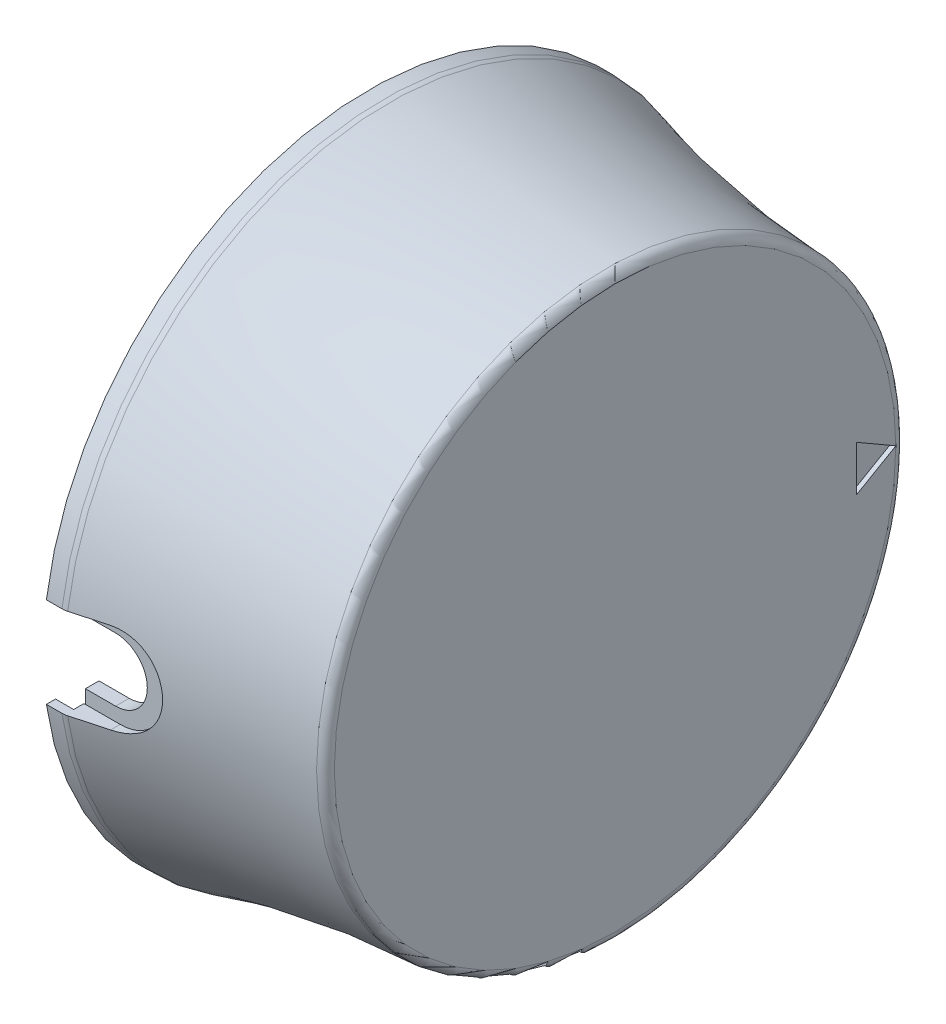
SolidWorks part; units mm, degrees
ref_plane "Plan de face" through (0, 0, 0) normal (0, 0, 1) x (1, 0, 0)
ref_plane "Plan de dessus" through (0, 0, 0) normal (0, 1, 0) x (1, 0, 0)
ref_plane "Plan de droite" through (0, 0, 0) normal (1, 0, 0) x (0, 0, -1)
sketch "Esquisse1" plane through (0, 0, 0) normal (0, 0, 1) x (1, 0, 0)
  line L0 (0, 0) -> (32.7513, 0) construction
  line L1 (0, 0) -> (0, 36)
  line L2 (0, 36) -> (1.7142, 36)
  line L3 (27.2, 0) -> (27.2, 31.0337)
  line L4 (27.2, 32) -> (14.7127, 32.3684) construction
  line L5 (0, 0) -> (27.2, 0)
  arc A0 (2.2717, 35.9207) -> (26.2391, 32.033) centre (30.1487, 131.9565) ccw
  arc A1 (27.2, 31.0337) -> (26.2391, 32.033) centre (26.2, 31.0337) ccw
  arc A2 (1.7142, 36) -> (2.2717, 35.9207) centre (1.7142, 34) cw
  point P14 (2, 36)
  dimension "D4" = 27.2
  dimension "D5" = 100
  dimension "D6" = 1
  dimension "D7" = 2
  dimension "D1" = 64
  dimension "D2" = 72
  dimension "D3" = 2
revolve "Révolution1" add sketch "Esquisse1" angle 360 about L5
shell "Coque1" thickness 2
sketch "Esquisse4" plane through (0, 0, 0) normal (-1, 0, 0) x (0, 0, 1)
  circle A2 centre (0, 0) radius 35
  circle A3 centre (0, 0) radius 35
  dimension "D1" = 1
extrude "Enlèv. mat.-Extru.2" cut sketch "Esquisse4" against normal blind 2
ref_plane "Plan1" through (0, 0, 32) normal (0, 0, 1) x (1, 0, 0)
sketch "Esquisse5" plane through (0, 0, 32) normal (0, 0, 1) x (1, 0, 0)
  line L0 (0, 36) -> (0, -36) construction
  line L1 (0, 5) -> (0, -5)
  line L2 (0, 0) -> (14.6376, 0) construction
  line L3 (0, 5) -> (25.2, 5)
  line L4 (0, -5) -> (25.2, -5)
  line L5 (25.2, 30.0766) -> (25.2, -30.0766) construction
  line L6 (25.2, 5) -> (25.2, -5)
  dimension "D1" = 10
extrude "Extrusion2" add sketch "Esquisse5" along normal up to surface (0.6915 mm away)
sketch "Esquisse6" plane through (0, 0, 32) normal (0, 0, -1) x (-1, 0, 0)
  line L0 (0, 3.5) -> (-5.5, 3.5)
  line L1 (0, -36) -> (0, 36) construction
  line L2 (-5.5, -3.5) -> (0, -3.5)
  line L3 (0, 0) -> (-12.0589, 0) construction
  line L4 (0, 5) -> (0, -5) construction
  line L5 (0, 3.5) -> (0, -3.5)
  arc A0 (-5.5, 3.5) -> (-5.5, -3.5) centre (-5.5, 0) ccw
  dimension "D2" = 9
  dimension "D1" = 7
extrude "Enlèv. mat.-Extru.3" cut sketch "Esquisse6" against normal through all
ref_plane "Plan2" through (0, 0, 37) normal (0, 0, -1) x (-1, 0, 0)
sketch "Esquisse7" plane through (0, 0, 37) normal (0, 0, -1) x (-1, 0, 0)
  line L0 (0, 0) -> (-12.3449, 0) construction
  line L1 (0, 5) -> (-6, 5)
  line L2 (-8.009, 5) -> (0, 5) construction
  line L3 (0, -5) -> (-8.009, -5) construction
  line L4 (-6, -5) -> (0, -5)
  line L5 (0, -36) -> (0, 36) construction
  line L6 (0, 5) -> (0, -5)
  arc A0 (-6, 5) -> (-6, -5) centre (-6, 0) ccw
  dimension "D1" = 11
extrude "Enlèv. mat.-Extru.4" cut sketch "Esquisse7" along normal offset from surface (3.5 mm away) 1.5
sketch "Esquisse8" plane through (0, 0, 33.5) normal (0, 0, 1) x (1, 0, 0)
  line L1 (2.1621, 5) -> (2.1621, -5)
  line L2 (2.1621, 5) -> (0, 5) construction
  line L3 (2.1621, 5) -> (0, 5)
  line L4 (0, -5) -> (2.1621, -5) construction
  line L5 (0, -5) -> (2.1621, -5)
  line L6 (0, 5) -> (0, -5)
extrude "Enlèv. mat.-Extru.5" cut sketch "Esquisse8" against normal up to next
sketch "Esquisse9" plane through (27.2, 0, 0) normal (1, 0, 0) x (0, 0, -1)
  line L0 (26.7036, 2.5) -> (26.7036, -2.5)
  line L1 (26.7036, -2.5) -> (31.0337, 0)
  line L2 (31.0337, 0) -> (26.7036, 2.5)
  circle A0 centre (0, 0) radius 31.0337 construction
  dimension "D1" = 5
extrude "Enlèv. mat.-Extru.6" cut sketch "Esquisse9" against normal blind 0.5
sketch "Esquisse10" plane through (0, 0, 0) normal (0, 1, 0) x (1, 0, 0)
  line L0 (0, 36) -> (0, -35.6511) construction
  line L1 (0, 32.2409) -> (0, 26)
  line L2 (0, 26) -> (22.332, 26)
  dimension "D1" = 26
rib "Nervure2" sketch "Esquisse10" sketch "Esquisse10" thickness 1.2 extrusion direction parallel to sketch draft on no parameters "D1"=1.2
sketch "Esquisse11" plane through (0, 0, 0) normal (0, 1, 0) x (1, 0, 0)
  line L0 (0, 26) -> (25.2, 26) construction
  line L1 (0, 26) -> (2.2, 26)
  line L2 (0, 34.9949) -> (0, 26) construction
  line L3 (0, 32) -> (0, 26)
  line L4 (0, 32) -> (2.2, 32)
  line L5 (2.2, 32) -> (2.2, 26)
  dimension "D1" = 2.2
  dimension "D2" = 6
extrude "Enlèv. mat.-Extru.7" cut sketch "Esquisse11" against normal up to next and the other way up to next
sketch "Esquisse12" plane through (25.2, 0, 0) normal (-1, 0, 0) x (0, 0, 1)
  line L0 (-26, -0.6) -> (-26, 0.6) construction
  circle A0 centre (-26, 0) radius 2.5
  dimension "D1" = 5
extrude "Extrusion3" add sketch "Esquisse12" along normal offset from surface (23.2 mm away) 0.2
sketch "Esquisse13" plane through (2, 0, 0) normal (-1, 0, 0) x (0, 0, 1)
  circle A0 centre (-26, 0) radius 0.85
  dimension "D1" = 1.7
extrude "Enlèv. mat.-Extru.8" cut sketch "Esquisse13" against normal up to surface (23.2 mm away)
pattern_circular "Répétition circulaire1" count 3 over 360 about axis through (0, 0, 0) along (1, 0, 0) of "Enlèv. mat.-Extru.8", "Extrusion3", "Enlèv. mat.-Extru.7", "Nervure2"
ref_plane "Plan3" through (0, 4, 0) normal (0, 1, 0) x (-1, 0, 0)
sketch "Esquisse14" plane through (0, 4, 0) normal (0, 1, 0) x (-1, 0, 0)
  line L0 (-24.2688, 29) -> (-8, 29)
  line L1 (-8, 29) -> (-8, 31.5033)
  dimension "D1" = 29
  dimension "D2" = 8
rib "Nervure3" sketch "Esquisse14" sketch "Esquisse14" thickness 1.5 extrusion direction parallel to sketch draft on no parameters "D1"=1.5
mirror "Symétrie1" about plane through (0, 0, 0) normal (0, 1, 0) of "Nervure3"
ref_plane "Plan appui moteur" through (22.2, 0, 0) normal (-1, 0, 0) x (0, 0, 1)
